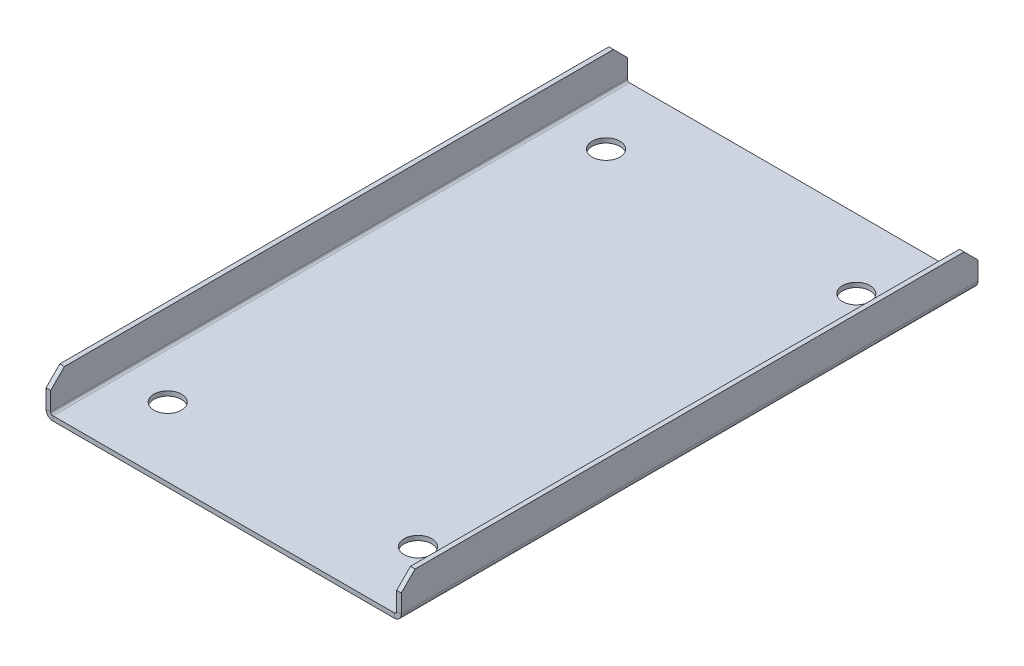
SolidWorks part; units mm, degrees
ref_plane "Face" through (0, 0, 0) normal (0, 0, 1) x (1, 0, 0)
ref_plane "Dessus" through (0, 0, 0) normal (0, 1, 0) x (1, 0, 0)
ref_plane "Droite" through (0, 0, 0) normal (1, 0, 0) x (0, 0, -1)
sketch "Esquisse1" plane through (0, 0, 0) normal (0, 0, 1) x (1, 0, 0)
  line L0 (0, 15) -> (0, 0)
  line L1 (0, 0) -> (150, 0)
  line L2 (150, 0) -> (150, 15)
  dimension "D1" = 150
  dimension "D2" = 15
extrude "Base-Extru.-Mince" add sketch "Esquisse1" against normal blind 250 thin
chamfer "Chanfrein1" distance 6 angle 45 4 edges at (-1, 15, -250) (-1, 15, 0) (151, 15, -250) (151, 15, 0)
sheet metal parameters "Tôlerie 1" parameters "D1"=1
bend "Pli dans angle2" parameters "D1"=0
flatten bends "Dépliage 1" parameters "D1"=3, "D4"=90, "D5"=1
sketch "Esquisse-Angle1" plane through (0, 0, 0) normal (0, 1, 0) x (-1, 0, 0)
  line L0 (0.5708, -250) -> (0.5708, 0) construction
  line L1 (-150.5708, 0) -> (-150.5708, -250) construction
bend "Pli dans angle1" bend angle 90 parameters "D1"=0, "D5"=2
sketch "Esquisse4" plane through (0, 0, 0) normal (0, 1, 0) x (-1, 0, 0)
  line L0 (-75, 0) -> (-75, -257.8606) construction
  line L1 (-1, 0) -> (-149, 0) construction
  circle A0 centre (-129.25, -220) radius 6
  circle A1 centre (-129.25, -30) radius 6
  circle A2 centre (-20.75, -220) radius 6
  circle A3 centre (-20.75, -30) radius 6
  dimension "D1" = 30
  dimension "D2" = 190
  dimension "D4" = 108.5
  dimension "D5" = 12
  dimension "D6" = 12
  dimension "D7" = 12
  dimension "D8" = 12
extrude "Enlèv. mat.-Extru.1" cut sketch "Esquisse4" against normal through all
process bends "Pliage 1" parameters "D1"=3
sketch "Esquisse-Plate1" plane through (0, 0, 0) normal (0, 1, 0) x (-1, 0, 0)
